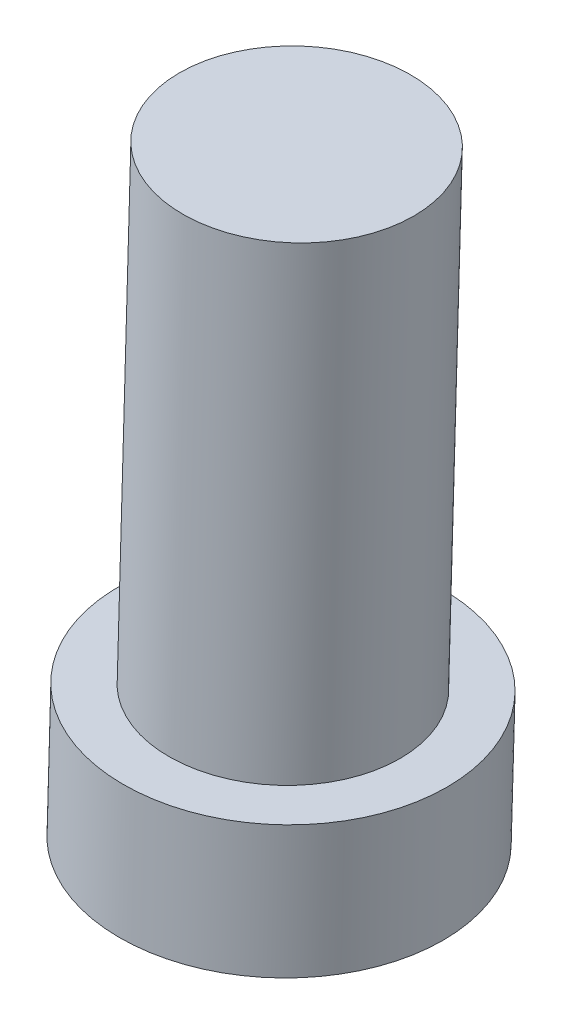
SolidWorks part; units mm, degrees
ref_plane "Plan de face" through (0, 0, 0) normal (0, 0, 1) x (1, 0, 0)
ref_plane "Plan de dessus" through (0, 0, 0) normal (0, 1, 0) x (1, 0, 0)
ref_plane "Plan de droite" through (0, 0, 0) normal (1, 0, 0) x (0, 0, -1)
ref_plane "Plan4" through (0, 0, -216.5675) normal (0, 0, 1) x (1, 0, 0)
sketch "Esquisse1" plane through (0, 0, -216.5675) normal (0, 0, 1) x (1, 0, 0)
  line L0 (-182.6179, 44.4246) -> (-192.6138, 44.7124)
  line L1 (-192.6138, 44.7124) -> (-194.1138, -7.3989)
  line L2 (-194.1138, -7.3989) -> (-180.1196, -7.8017)
  line L3 (-180.1196, -7.8017) -> (-179.7894, 3.6712)
  line L4 (-179.7894, 3.6712) -> (-183.7877, 3.7863)
  line L5 (-183.7877, 3.7863) -> (-182.6179, 44.4246)
  line L6 (-192.6032, 45.0812) -> (-194.1254, -7.8014) construction
revolve "Révolution1" add sketch "Esquisse1" angle 360 about L6
